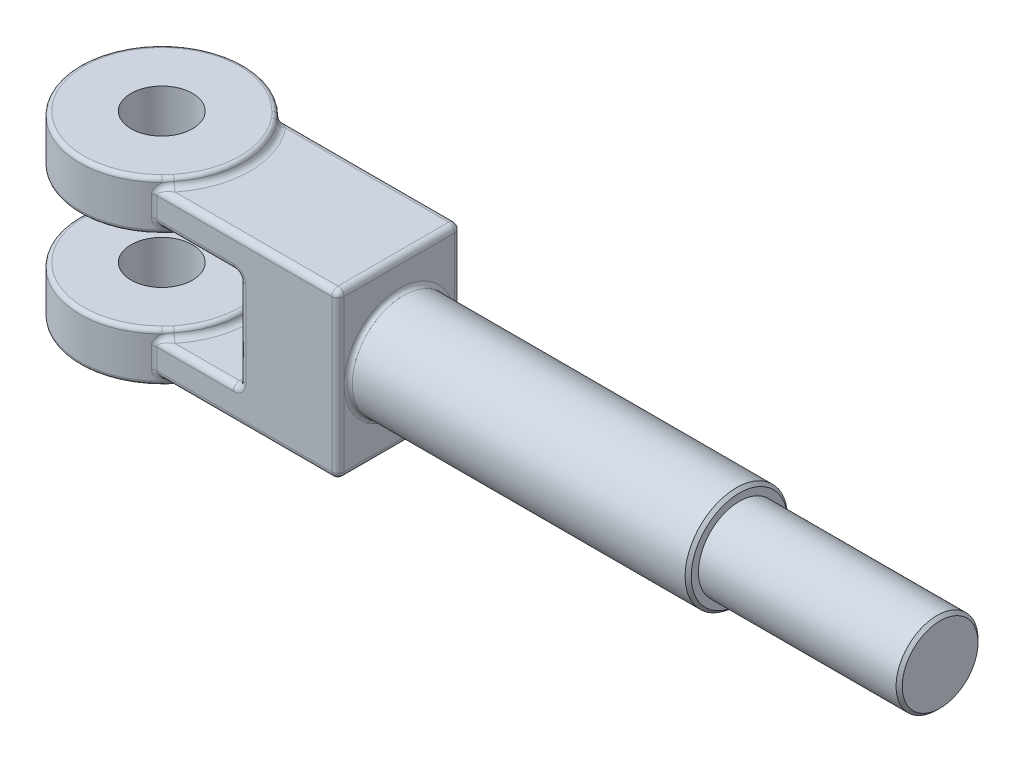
SolidWorks part; units mm, degrees
ref_plane "Plane1" through (0, 0, 0) normal (0, 0, 1) x (1, 0, 0)
ref_plane "Plane2" through (0, 0, 0) normal (0, 1, 0) x (1, 0, 0)
ref_plane "Plane3" through (0, 0, 0) normal (1, 0, 0) x (0, 0, -1)
sketch "Esquisse1" plane through (0, 0, 0) normal (0, 0, 1) x (1, 0, 0)
  line L0 (-98, 40) -> (-3, 40)
  line L1 (-98, 40) -> (-98, 24)
  line L2 (-3, -40) -> (-98, -40)
  line L3 (0, -37) -> (0, 37)
  line L4 (-98, 24) -> (-51, 24)
  line L5 (-48, 21) -> (-48, -21)
  line L6 (-51, -24) -> (-98, -24)
  line L7 (-98, -24) -> (-98, -40)
  arc A0 (0, 37) -> (-3, 40) centre (-3, 37) ccw
  arc A1 (0, -37) -> (-3, -40) centre (-3, -37) cw
  arc A2 (-48, 21) -> (-51, 24) centre (-51, 21) ccw
  arc A3 (-48, -21) -> (-51, -24) centre (-51, -21) cw
  point P11 (0, 40)
  point P14 (0, -40)
  point P17 (-48, 24)
  point P20 (-48, -24)
  dimension "D6" = 3
  dimension "D1" = 48
  dimension "D2" = 80
  dimension "D3" = 48
  dimension "D4" = 50
  dimension "D5" = 16
  dimension "D7" = 24
  dimension "D8" = 48
extrude "Base-Extrusion" add sketch "Esquisse1" along normal mid plane 60
sketch "Esquisse3" plane through (0, 0, 0) normal (1, 0, 0) x (0, 0, -1)
  circle A0 centre (0, 0) radius 25
  dimension "D1" = 50
extrude "Boss.-Extru.1" add sketch "Esquisse3" along normal blind 166
sketch "Esquisse4" plane through (166, 0, 0) normal (1, 0, 0) x (0, 0, -1)
  circle A0 centre (0, 0) radius 20
  dimension "D1" = 40
extrude "Boss.-Extru.2" add sketch "Esquisse4" along normal blind 98
sketch "Esquisse5" plane through (0, 0, 0) normal (0, 1, 0) x (1, 0, 0)
  line L0 (166, 0) -> (0, 0) construction
  circle A0 centre (-116, 0) radius 40
  dimension "D1" = 80
  dimension "D2" = 116
extrude "Boss.-Extru.3" add sketch "Esquisse5" along normal mid plane 88
sketch "Esquisse6" plane through (0, 44, 0) normal (0, 1, 0) x (-1, 0, 0)
  circle A0 centre (116, 0) radius 15
  circle A1 centre (116, 0) radius 40 construction
  dimension "D1" = 30
extrude "Enlèv. mat.-Extru.1" cut sketch "Esquisse6" against normal through all
sketch "Esquisse8" plane through (0, 0, 0) normal (0, 0, 1) x (1, 0, 0)
  line L0 (-163.2753, 0) -> (-68.0591, 0)
  line L1 (166, 0) -> (0, 0) construction
extrude "Enlèv. de mat.-Extru.-Mince1" cut sketch "Esquisse8" against normal through all thin
sketch "Esquisse9" plane through (0, 0, 0) normal (0, 1, 0) x (1, 0, 0)
  line L0 (166, 0) -> (0, 0) construction
  circle A0 centre (-116, 0) radius 40
  dimension "D2" = 80
  dimension "D1" = 116
extrude "Boss.-Extru.4" add sketch "Esquisse9" along normal mid plane 88
sketch "Esquisse10" plane through (0, 0, 0) normal (0, 0, 1) x (1, 0, 0)
  line L0 (-166.3141, 0) -> (-64.0073, 0)
extrude "Enlèv. de mat.-Extru.-Mince2" cut sketch "Esquisse10" against normal mid plane 88 thin
fillet "Congé2" radius 3 28 edges at (-48.8787, 23.1213, 30) (-0.8787, 39.1213, -30) (0, 0, -30) (-0.8787, -39.1213, -30) (-46.2712, -40, -30) (-48, 0, 30) (-70.2712, -24, -30) (-48.8787, -23.1213, -30) (-48, 0, -30) (-48.8787, 23.1213, -30) (-48.8787, -23.1213, 30) (-70.2712, -24, 30) (-46.2712, -40, 30) (-0.8787, -39.1213, 30) (0, 0, 30) (-0.8787, 39.1213, 30) (-46.2712, 40, -30) (-70.2712, 24, -30) (-89.5425, -32, -30) (-89.5425, 32, -30) (-70.2712, 24, 30) (-46.2712, 40, 30) (-76, 40, 0) (-89.5425, 32, 30) (-89.5425, -32, 30) (-76, -40, 0) (-76, 24, 0) (-76, -24, 0)
fillet "Congé3" radius 2 12 edges at (-76, -21, 0) (-76, -43, 0) (-76, 43, 0) (-76, 21, 0) (-89.5126, -39.9554, 29.9736) (-89.5126, -24.0446, -29.9736) (-89.5126, 24.0446, 29.9736) (-89.5126, 39.9554, -29.9736) (-116, -44, 40) (-116, 44, 40) (-116, -20, -40) (-116, 20, -40)
fillet "Congé4" radius 2 1 edges at (0, 0, 25)
chamfer "Chanfrein1" distance 1.5 angle 45 2 edges at (166, 0, -25) (264, 0, -20)
sketch "Esquisse11" plane through (0, -44, 0) normal (0, -1, 0) x (1, 0, 0)
  circle A0 centre (-116, 0) radius 15
  dimension "D1" = 30
extrude "Enlèv. mat.-Extru.2" cut sketch "Esquisse11" against normal through all
